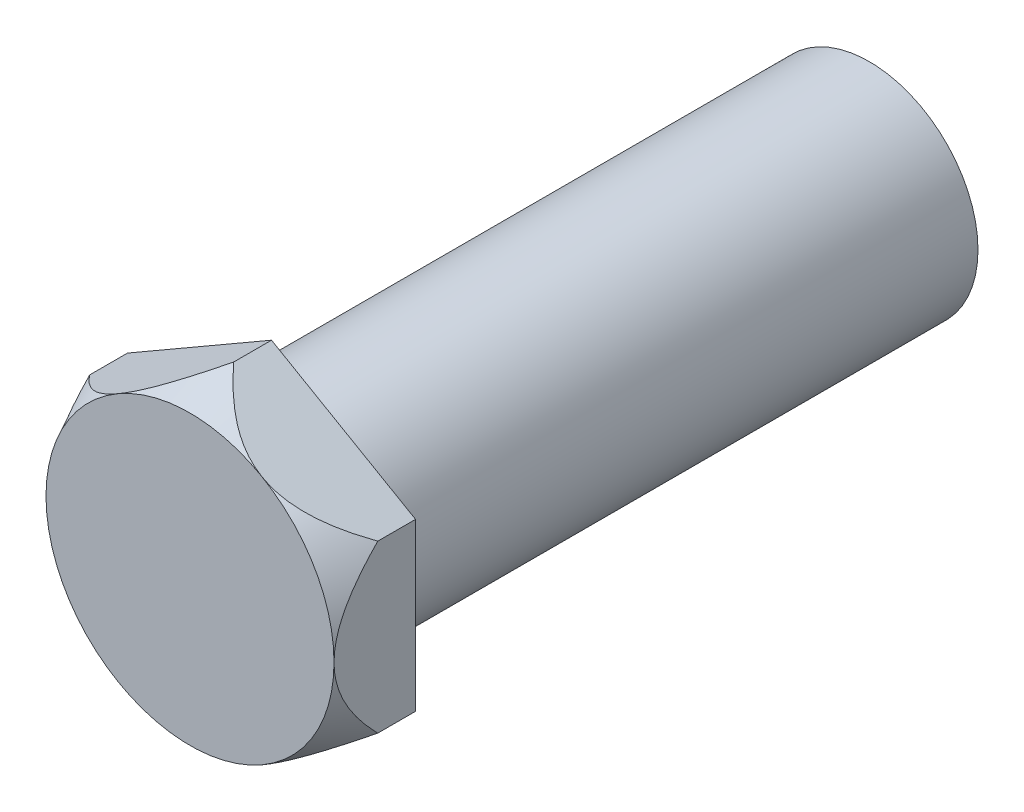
SolidWorks part; units mm, degrees
ref_plane "Front Plane" through (0, 0, 0) normal (0, 0, 1) x (1, 0, 0)
ref_plane "Top Plane" through (0, 0, 0) normal (0, 1, 0) x (1, 0, 0)
ref_plane "Right Plane" through (0, 0, 0) normal (1, 0, 0) x (0, 0, -1)
sketch "Sketch1" plane through (0, 0, 0) normal (0, 0, 1) x (1, 0, 0)
  line L1 (0, 3.06) -> (-2.65, 1.53)
  line L2 (-2.65, 1.53) -> (-2.65, -1.53)
  line L3 (-2.65, -1.53) -> (0, -3.06)
  line L4 (0, -3.06) -> (2.65, -1.53)
  line L5 (2.65, -1.53) -> (2.65, 1.53)
  line L6 (2.65, 1.53) -> (0, 3.06)
  circle A0 centre (0, 0) radius 2.65 construction
extrude "Boss-Extrude1" add sketch "Sketch1" along normal blind 1.5
sketch "Sketch2" plane through (0, 0, 1.5) normal (0, 0, 1) x (1, 0, 0)
  circle A0 centre (0, 0) radius 2.65
extrude "Cut-Extrude2" cut sketch "Sketch2" against normal through all draft 27 flip side to cut
sketch "Sketch3" plane through (0, 0, 0) normal (0, 0, -1) x (-1, 0, 0)
  circle A0 centre (0, 0) radius 2
extrude "Boss-Extrude2" add sketch "Sketch3" along normal blind 11
